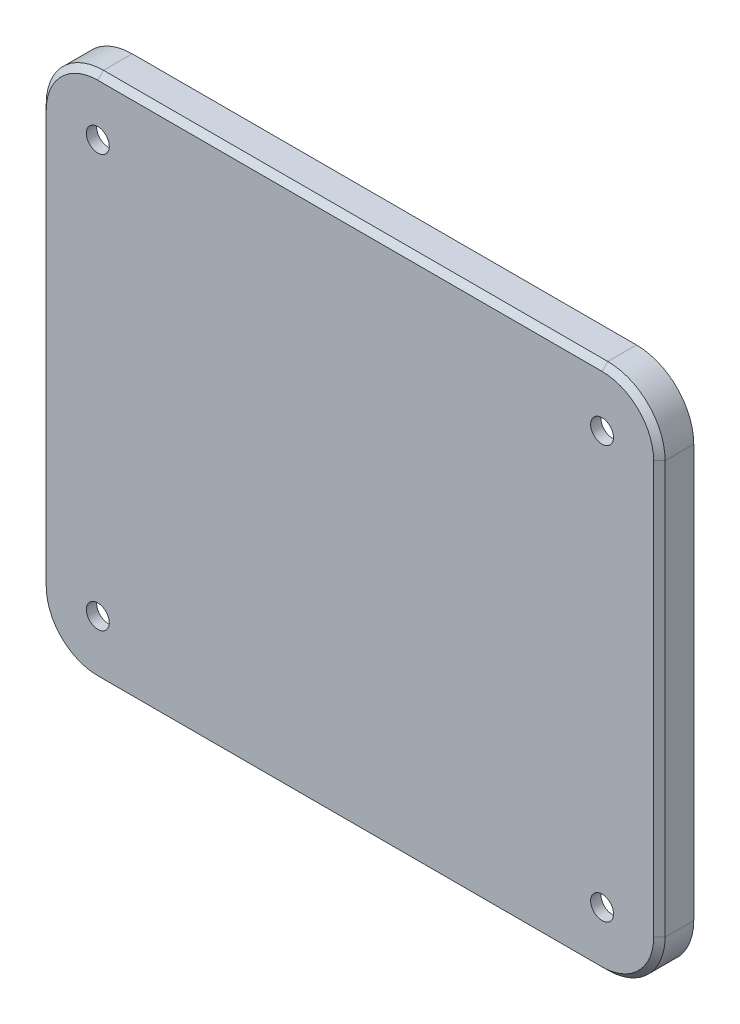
SolidWorks part; units mm, degrees
ref_plane "Plan de face" through (0, 0, 0) normal (0, 0, 1) x (1, 0, 0)
ref_plane "Plan de dessus" through (0, 0, 0) normal (0, 1, 0) x (1, 0, 0)
ref_plane "Plan de droite" through (0, 0, 0) normal (1, 0, 0) x (0, 0, -1)
sketch "Esquisse1" plane through (0, 0, 0) normal (0, 0, 1) x (1, 0, 0)
  line L0 (-44, -36) -> (44, 36) construction
  line L2 (44, -46) -> (-44, -46)
  line L3 (54, -36) -> (54, 36)
  line L4 (44, 46) -> (-44, 46)
  line L5 (-54, -36) -> (-54, 36)
  line L6 (54, -46) -> (-54, 46) construction
  line L7 (54, 46) -> (-54, -46) construction
  circle A0 centre (-44, -36) radius 2
  circle A1 centre (44, -36) radius 2
  circle A2 centre (44, 36) radius 2
  circle A3 centre (-44, 36) radius 2
  arc A4 (-54, -36) -> (-44, -46) centre (-44, -36) ccw
  arc A5 (44, -46) -> (54, -36) centre (44, -36) ccw
  arc A6 (54, 36) -> (44, 46) centre (44, 36) ccw
  arc A7 (-44, 46) -> (-54, 36) centre (-44, 36) ccw
  point P2 (0, 0)
  point P4 (0, 0)
  dimension "D3" = 72
  dimension "D5" = 10
  dimension "D6" = 4
  dimension "D4" = 88
  dimension "D1" = 2
  dimension "D2" = 2
extrude "Boss.-Extru.1" add sketch "Esquisse1" along normal blind 6
shell "Coque1" thickness 1.8
fillet "Congé1" radius 1.8 8 edges at (-49.7983, 41.7983, 4.2) (0, 44.2, 4.2) (49.7983, 41.7983, 4.2) (52.2, 0, 4.2) (49.7983, -41.7983, 4.2) (0, -44.2, 4.2) (-49.7983, -41.7983, 4.2) (-52.2, 0, 4.2)
chamfer "Chanfrein1" distance 1 angle 45 8 edges at (-54, 0, 6) (-51.0711, -43.0711, 6) (-51.0711, 43.0711, 6) (0, -46, 6) (0, 46, 6) (51.0711, -43.0711, 6) (51.0711, 43.0711, 6) (54, 0, 6)
